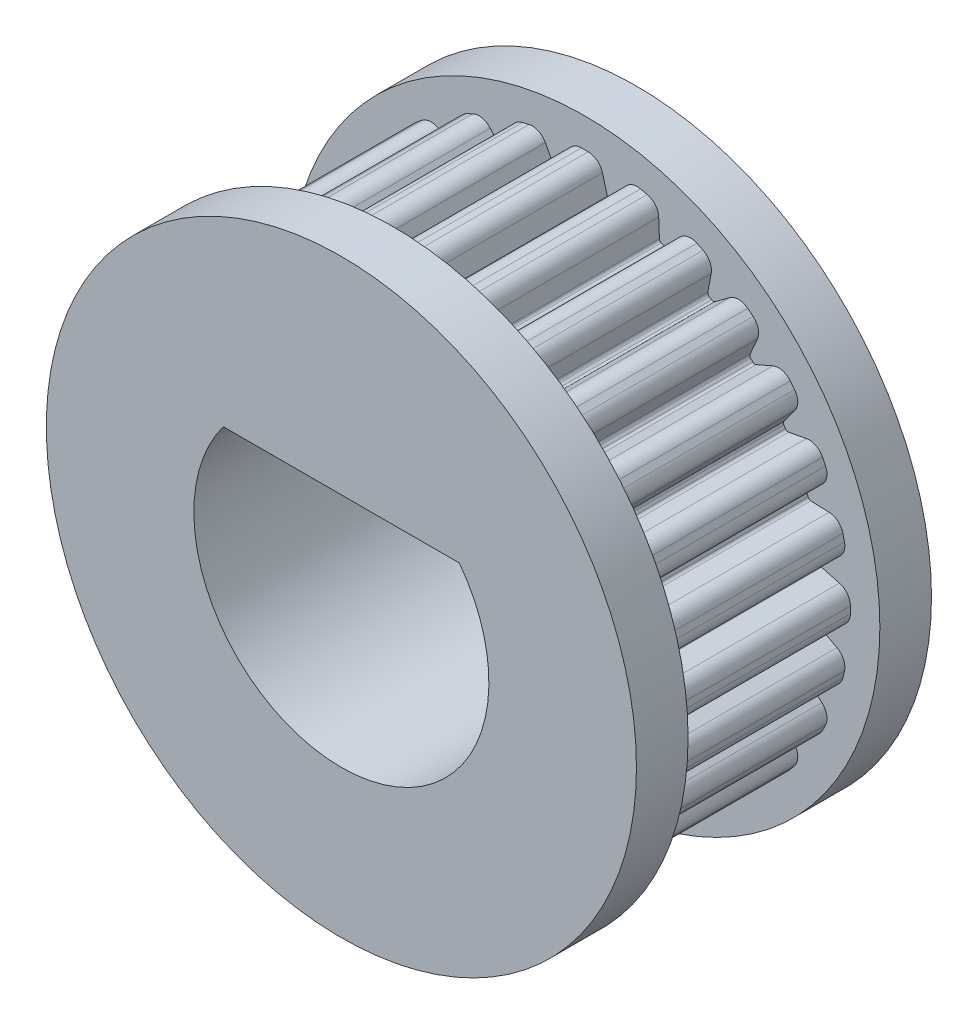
SolidWorks part; units mm, degrees
ref_plane "Alzado" through (0, 0, 0) normal (0, 0, 1) x (1, 0, 0)
ref_plane "Planta" through (0, 0, 0) normal (0, 1, 0) x (1, 0, 0)
ref_plane "Vista lateral" through (0, 0, 0) normal (1, 0, 0) x (0, 0, -1)
sketch "Croquis1" plane through (0, 0, 0) normal (0, 0, 1) x (1, 0, 0)
  line L0 (4, 3) -> (-4, 3)
  line L1 (0, -5) -> (0, -10) construction
  circle A0 centre (0, 0) radius 10
  arc A1 (-4, 3) -> (4, 3) centre (0, 0) ccw
  dimension "D2" = 5
  dimension "D3" = 20
  dimension "D1" = 8
extrude "Saliente-Extruir1" add sketch "Croquis1" along normal blind 10
sketch "Croquis2" plane through (0, 0, 10) normal (0, 0, 1) x (1, 0, 0)
  circle A0 centre (0, 0) radius 8
  circle A1 centre (0, 0) radius 12
  dimension "D1" = 24
  dimension "D2" = 16
extrude "Cortar-Extruir1" cut sketch "Croquis2" against normal blind 6.5 from offset 1.75
sketch "Croquis3" plane through (0, 0, 1.75) normal (0, 0, 1) x (1, 0, 0)
  line L0 (-0.5, 9) -> (-1.0359, 7)
  line L1 (-1.0359, 7) -> (1.0359, 7)
  line L2 (1.0359, 7) -> (0.5, 9)
  line L3 (0.5, 9) -> (-0.5, 9)
  line L4 (0, 7) -> (0, 0) construction
  dimension "D1" = 75
  dimension "D2" = 75
  dimension "D3" = 1
  dimension "D4" = 7
  dimension "D5" = 2
extrude "Saliente-Extruir2" add sketch "Croquis3" along normal up to surface (6.5 mm away)
fillet "Redondeo1" radius 0.5 2 edges at (0.5, 9, 5) (-0.5, 9, 5)
fillet "Redondeo2" radius 0.1 2 edges at (0.7781, 7.9621, 5) (-0.7781, 7.9621, 5)
pattern_circular "MatrizC1" count 28 over 360 about axis through (0, 0, 0) along (0, 0, 1) of "Saliente-Extruir2", "Redondeo1", "Redondeo2"
